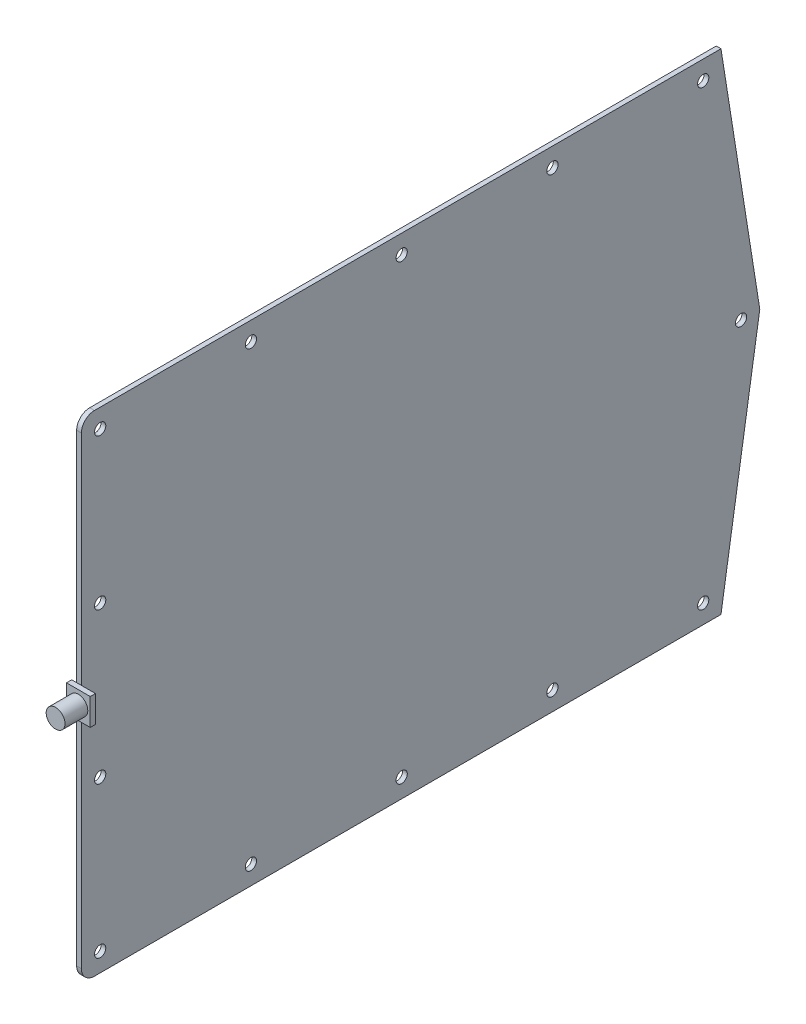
SolidWorks part; units mm, degrees
ref_plane "Front Plane" through (0, 0, 0) normal (0, 0, 1) x (1, 0, 0)
ref_plane "Top Plane" through (0, 0, 0) normal (0, 1, 0) x (1, 0, 0)
ref_plane "Right Plane" through (0, 0, 0) normal (1, 0, 0) x (0, 0, -1)
sketch "Sketch1" plane through (0, 0, 0) normal (1, 0, 0) x (0, 0, -1)
  line L0 (46.5448, 82.55) -> (59.6258, 0)
  line L1 (-168.9742, 82.55) -> (46.5448, 82.55)
  line L2 (-168.9742, 82.55) -> (-168.9742, -82.55)
  line L3 (-168.9742, -82.55) -> (46.5448, -82.55)
  line L4 (59.6258, 0) -> (46.5448, -82.55)
  point P4 (-168.9742, 0)
  dimension "D1" = 165.1
  dimension "D2" = 215.519
  dimension "D3" = 228.6
extrude "Boss-Extrude1" add sketch "Sketch1" along normal blind 1.6002
fillet "Fillet1" radius 4.3942
sketch "Sketch3" plane through (1.6002, 0, 0) normal (1, 0, 0) x (0, 0, -1)
  line L0 (40.5504, -76.2) -> (-10.2496, -76.2) construction
  line L1 (-10.2496, -76.2) -> (-61.0496, -76.2) construction
  line L2 (-61.0496, -76.2) -> (-111.8496, -76.2) construction
  line L3 (-111.8496, -76.2) -> (-162.6496, -76.2) construction
  line L4 (-162.6496, -76.2) -> (-162.6496, -25.4) construction
  line L5 (-162.6496, -25.4) -> (-162.6496, 25.4) construction
  line L6 (-162.6496, 25.4) -> (-162.6496, 76.2) construction
  line L7 (-162.6496, 76.2) -> (-111.8496, 76.2) construction
  line L8 (-111.8496, 76.2) -> (-61.0496, 76.2) construction
  line L9 (-61.0496, 76.2) -> (-10.2496, 76.2) construction
  line L10 (-10.2496, 76.2) -> (40.5504, 76.2) construction
  line L12 (59.6258, 0) -> (-162.6496, 0) construction
  line L13 (-168.9742, 78.1558) -> (-168.9742, -78.1558) construction
  circle A0 centre (40.5504, -76.2) radius 1.8923
  circle A1 centre (-10.2496, -76.2) radius 1.8923
  circle A2 centre (-61.0496, -76.2) radius 1.8923
  circle A3 centre (-111.8496, -76.2) radius 1.8923
  circle A4 centre (-162.6496, -76.2) radius 1.8923
  circle A5 centre (-162.6496, -25.4) radius 1.8923
  circle A6 centre (-162.6496, 25.4) radius 1.8923
  circle A7 centre (-162.6496, 76.2) radius 1.8923
  circle A8 centre (-111.8496, 76.2) radius 1.8923
  circle A9 centre (-61.0496, 76.2) radius 1.8923
  circle A10 centre (-10.2496, 76.2) radius 1.8923
  circle A11 centre (40.5504, 76.2) radius 1.8923
  circle A12 centre (53.3012, 0) radius 1.8923
  point P25 (-164.5419, 76.2)
  point P34 (55.1935, 0)
  dimension "D1" = 3.7846
  dimension "D2" = 152.4
  dimension "D3" = 4.4323
  dimension "D4" = 4.4323
extrude "Cut-Extrude1" cut sketch "Sketch3" against normal through all
sketch "Sketch4" plane through (0, 0, 168.9742) normal (0, 0, 1) x (1, 0, 0)
  line L0 (1.6002, 78.1558) -> (1.6002, -78.1558) construction
  line L1 (-1.6637, 4.5149) -> (6.3246, 4.5149)
  line L2 (-1.6637, 4.5149) -> (-1.6637, -4.5149)
  line L3 (-1.6637, -4.5149) -> (6.3246, -4.5149)
  line L4 (6.3246, 4.5149) -> (6.3246, -4.5149)
  point P4 (6.3246, 0)
  dimension "D1" = 7.9883
  dimension "D2" = 9.0297
  dimension "D3" = 4.7244
extrude "Boss-Extrude2" add sketch "Sketch4" along normal blind 1.7526
sketch "Sketch5" plane through (0, 0, 170.7268) normal (0, 0, 1) x (1, 0, 0)
  line L0 (-1.6637, 4.5149) -> (6.3246, -4.5149) construction
  circle A0 centre (2.3305, 0) radius 3.175
  point P6 (2.3305, 0)
  dimension "D1" = 6.35
extrude "Boss-Extrude3" add sketch "Sketch5" along normal blind 7.6708
